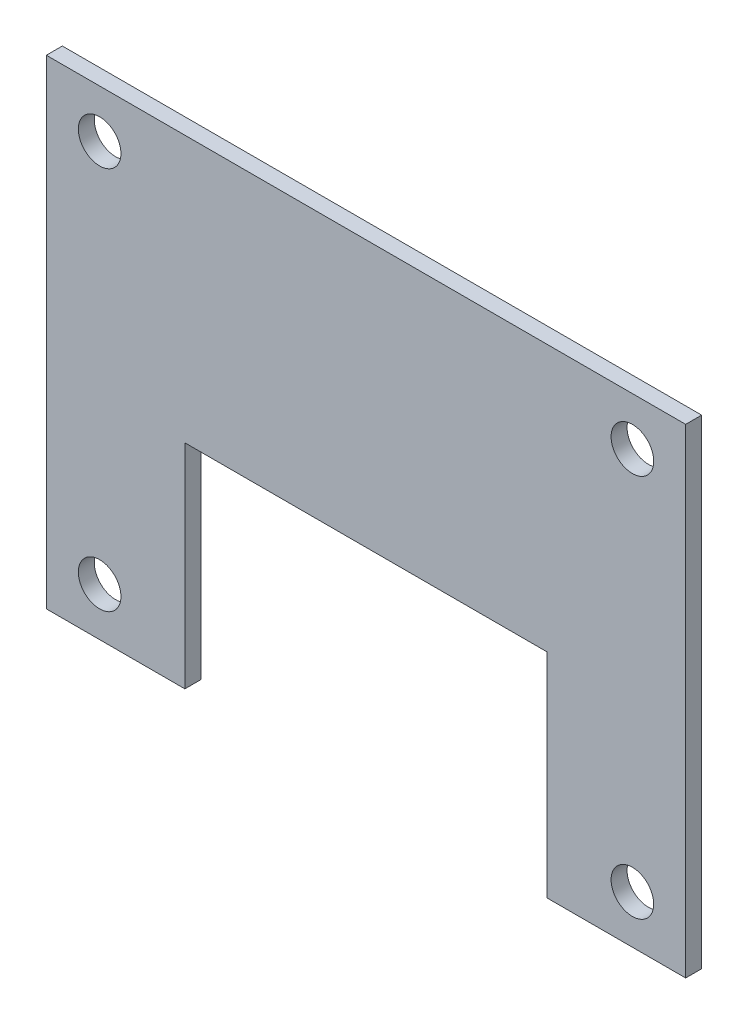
SolidWorks part; units mm, degrees
ref_plane "Face" through (0, 0, 0) normal (0, 0, 1) x (1, 0, 0)
ref_plane "Dessus" through (0, 0, 0) normal (0, 1, 0) x (1, 0, 0)
ref_plane "Droite" through (0, 0, 0) normal (1, 0, 0) x (0, 0, -1)
sketch "Esquisse1" plane through (0, 0, 0) normal (0, 0, 1) x (1, 0, 0)
  line L0 (0, 0) -> (0, 45)
  line L1 (0, 45) -> (60, 45)
  line L2 (60, 45) -> (60, 0)
  line L3 (60, 0) -> (47, 0)
  line L4 (47, 0) -> (47, 20)
  line L5 (47, 20) -> (13, 20)
  line L6 (13, 20) -> (13, 0)
  line L7 (13, 0) -> (0, 0)
  circle A0 centre (5, 40.5) radius 2
  circle A1 centre (55, 40.5) radius 2
  circle A2 centre (55, 4.5) radius 2
  circle A3 centre (5, 4.5) radius 2
  dimension "D6" = 4
  dimension "D7" = 4
  dimension "D9" = 4
  dimension "D10" = 4
  dimension "D14" = 50
  dimension "D1" = 45
  dimension "D2" = 60
  dimension "D3" = 34
  dimension "D4" = 13
  dimension "D5" = 20
  dimension "D8" = 36
  dimension "D11" = 36
  dimension "D12" = 4.5
  dimension "D13" = 4.5
  dimension "D15" = 5
extrude "Extrusion1" add sketch "Esquisse1" along normal blind 1.5
